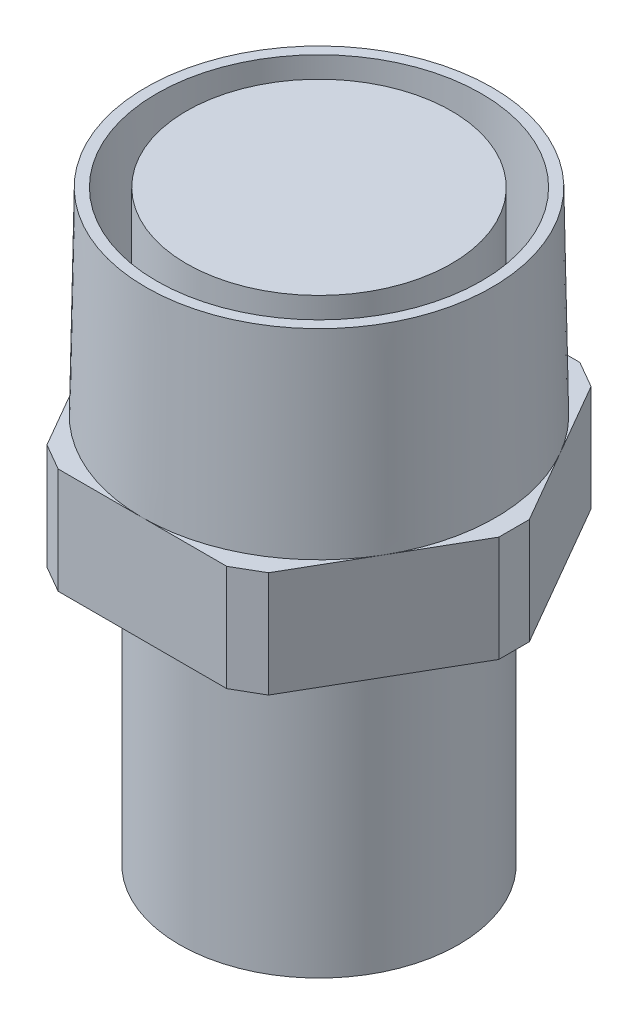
SolidWorks part; units mm, degrees
ref_plane "Plan de face" through (0, 0, 0) normal (0, 0, 1) x (1, 0, 0)
ref_plane "Plan de dessus" through (0, 0, 0) normal (0, 1, 0) x (1, 0, 0)
ref_plane "Plan de droite" through (0, 0, 0) normal (1, 0, 0) x (0, 0, -1)
sketch "Esquisse1" plane through (0, 0, 0) normal (0, 1, 0) x (1, 0, 0)
  line L1 (5.7735, 0) -> (2.8868, 5)
  line L2 (2.8868, 5) -> (-2.8868, 5)
  line L3 (-2.8868, 5) -> (-5.7735, 0)
  line L4 (-5.7735, 0) -> (-2.8868, -5)
  line L5 (-2.8868, -5) -> (2.8868, -5)
  line L6 (2.8868, -5) -> (5.7735, 0)
  circle A0 centre (0, 0) radius 5 construction
  dimension "D1" = 10
extrude "Extrusion1" add sketch "Esquisse1" along normal blind 3
sketch "Esquisse2" plane through (0, 3, 0) normal (0, 1, 0) x (1, 0, 0)
  circle A0 centre (0, 0) radius 5
  circle A1 centre (0, 0) radius 4.5
  dimension "D1" = 10
  dimension "D2" = 0.5
extrude "Extrusion2" add sketch "Esquisse2" along normal blind 5.6 draft 1
sketch "Esquisse3" plane through (0, 0, 0) normal (0, -1, 0) x (1, 0, 0)
  circle A0 centre (0, 0) radius 3.95
  dimension "D1" = 7.9
extrude "Extrusion3" add sketch "Esquisse3" along normal blind 8
chamfer "Chanfrein1" distance 0.5 distance2 0.5 6 edges at (2.8868, 1.5, 5) (5.7735, 1.5, 0) (2.8868, 1.5, -5) (-2.8868, 1.5, -5) (-2.8868, 1.5, 5) (-5.7735, 1.5, 0)
sketch "Esquisse4" plane through (0, 3, 0) normal (0, 1, 0) x (1, 0, 0)
  circle A0 centre (0, 0) radius 3.75
  dimension "D1" = 7.5
extrude "Extrusion4" add sketch "Esquisse4" along normal up to surface (5.6 mm away)
